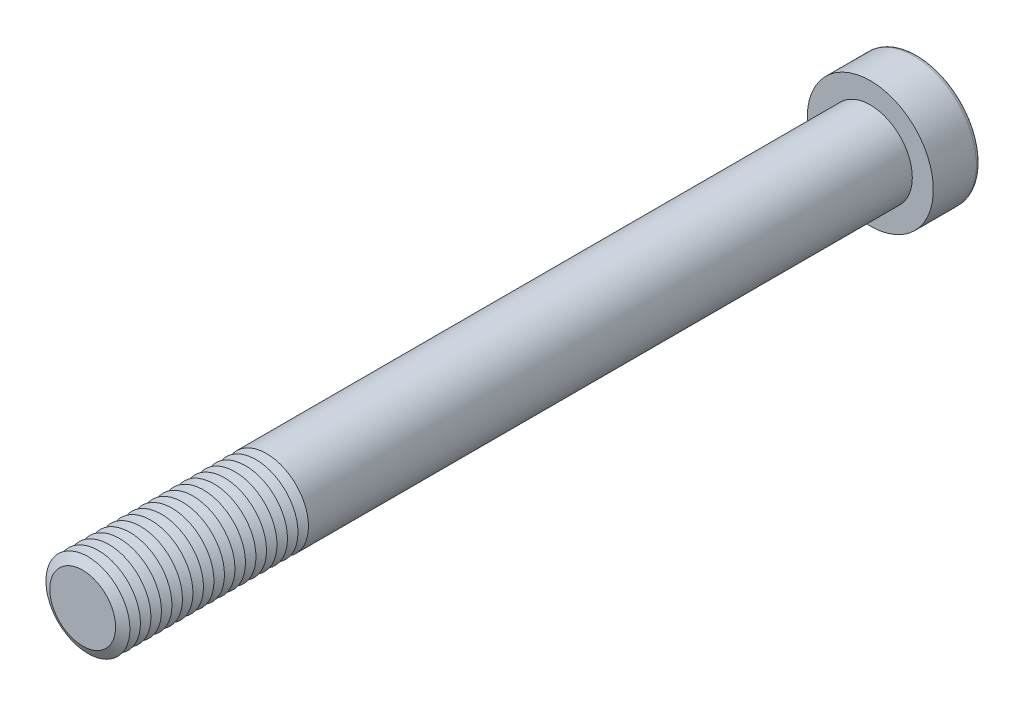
SolidWorks part; units mm, degrees
ref_plane "Front Plane" through (0, 0, 0) normal (0, 0, 1) x (1, 0, 0)
ref_plane "Top Plane" through (0, 0, 0) normal (0, 1, 0) x (1, 0, 0)
ref_plane "Right Plane" through (0, 0, 0) normal (1, 0, 0) x (0, 0, -1)
sketch "Sketch1" plane through (0, 0, 0) normal (0, 0, 1) x (1, 0, 0)
  circle A0 centre (0, 0) radius 8
  dimension "D1" = 16
extrude "Boss-Extrude1" add sketch "Sketch1" along normal blind 150
sketch "Sketch2" plane through (0, 0, 0) normal (0, 0, -1) x (-1, 0, 0)
  circle A0 centre (0, 0) radius 12
  dimension "D1" = 24
extrude "Boss-Extrude2" add sketch "Sketch2" along normal blind 9
sketch "Sketch3" plane through (0, 0, -9) normal (0, 0, -1) x (-1, 0, 0)
  line L1 (-3.4641, 6) -> (-6.9282, 0)
  line L2 (-6.9282, 0) -> (-3.4641, -6)
  line L3 (-3.4641, -6) -> (3.4641, -6)
  line L4 (3.4641, -6) -> (6.9282, 0)
  line L5 (6.9282, 0) -> (3.4641, 6)
  line L6 (3.4641, 6) -> (-3.4641, 6)
  circle A0 centre (0, 0) radius 6 construction
  dimension "D1" = 12
extrude "Cut-Extrude1" cut sketch "Sketch3" against normal blind 9
fillet "Fillet1" radius 0.8 1 edges at (-12, 0, -9)
sketch "Sketch4" plane through (0, 0, 0) normal (0, 0, -1) x (-1, 0, 0)
  line L0 (3.4641, -6) -> (6.9282, 0) construction
  circle A0 centre (0, 0) radius 6
extrude "Cut-Extrude2" cut sketch "Sketch4" against normal through all draft 60
sketch "Sketch5" plane through (0, 0, -9) normal (0, 0, -1) x (-1, 0, 0)
  circle A0 centre (0, 0) radius 6.9282
extrude "Cut-Extrude3" cut sketch "Sketch5" against normal through all draft 75
sketch "Sketch7" plane through (0, 0, 0) normal (1, 0, 0) x (0, 0, -1)
  line L25 (-150, 6.2679) -> (-149, 8)
  line L26 (-150, 8) -> (-150, -8) construction
  line L27 (-149, 8) -> (-151, 8)
  line L28 (-151, 8) -> (-150, 6.2679)
  line L29 (0, 8) -> (-150, 8) construction
  dimension "D1" = 2
revolve "Cut-Revolve1" cut sketch "Sketch7" angle 360 about axis through (0, 0, 150) along (0, 0, -1)
pattern_linear "LPattern1" count 18 spacing 2 along (0, 0, -1) of "Cut-Revolve1"
